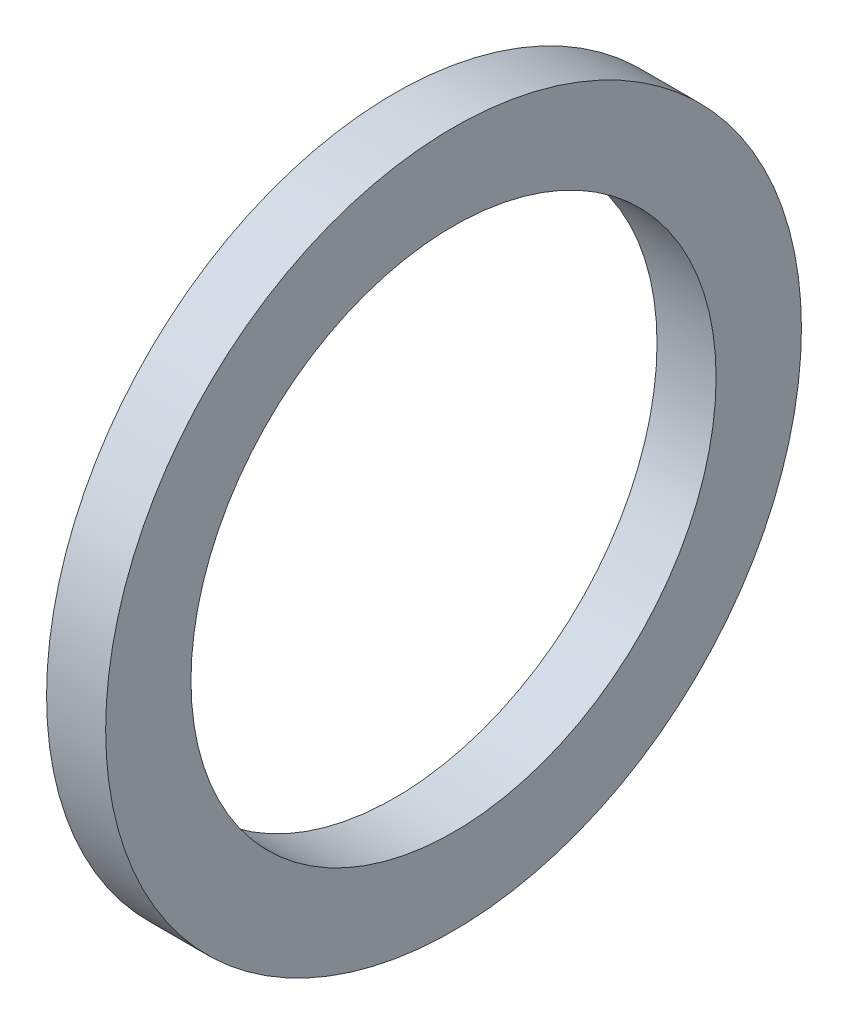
SolidWorks part; units mm, degrees
ref_plane "Front Plane" through (0, 0, 0) normal (0, 0, 1) x (1, 0, 0)
ref_plane "Top Plane" through (0, 0, 0) normal (0, 1, 0) x (1, 0, 0)
ref_plane "Right Plane" through (0, 0, 0) normal (1, 0, 0) x (0, 0, -1)
sketch "Sketch1" plane through (0, 0, 0) normal (1, 0, 0) x (0, 0, -1)
  circle A0 centre (0, 0) radius 4
  circle A1 centre (0, 0) radius 5.3
  dimension "D1" = 10.6
  dimension "D2" = 8
extrude "Boss-Extrude1" add sketch "Sketch1" along normal mid plane 0.9
